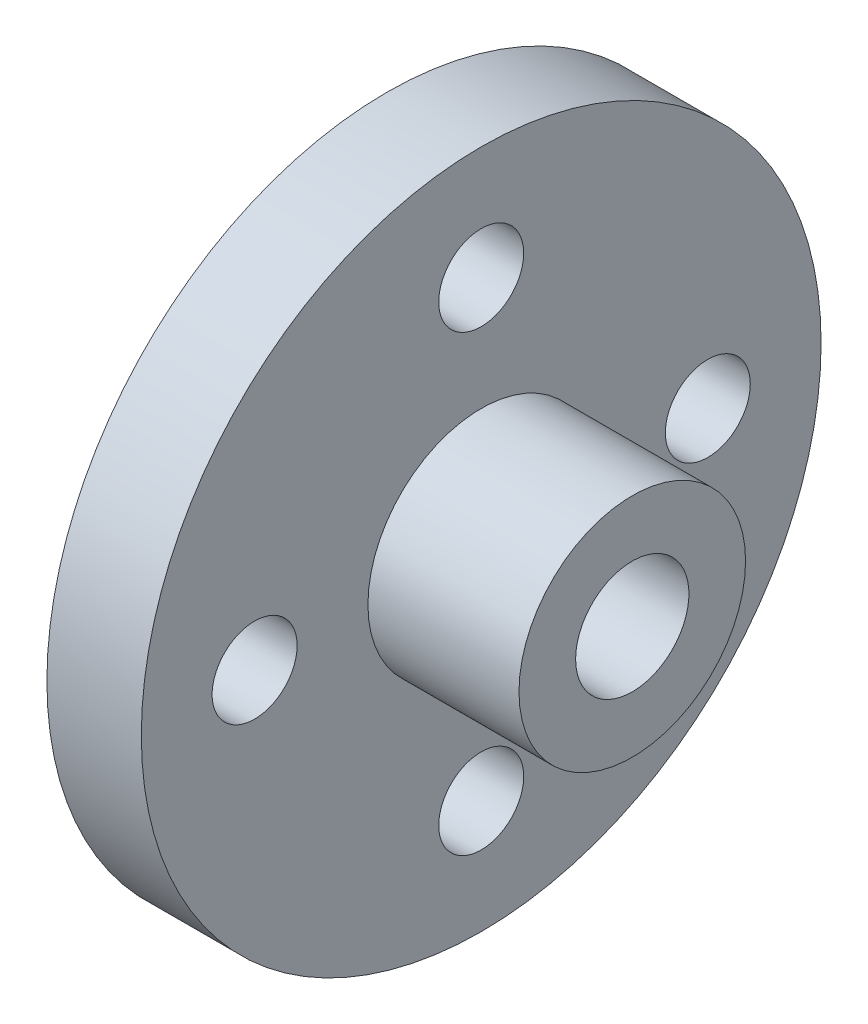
SolidWorks part; units mm, degrees
ref_plane "Front" through (0, 0, 0) normal (0, 0, 1) x (1, 0, 0)
ref_plane "Top" through (0, 0, 0) normal (0, 1, 0) x (1, 0, 0)
ref_plane "Right" through (0, 0, 0) normal (1, 0, 0) x (0, 0, -1)
sketch "Sketch1" plane through (0, 0, 0) normal (0, 0, 1) x (1, 0, 0)
  line L0 (-16.9595, 0) -> (19.5465, 0) construction
  line L1 (-7.9375, 0) -> (-7.9375, 28.575)
  line L2 (-7.9375, 28.575) -> (0, 28.575)
  line L3 (0, 28.575) -> (0, 9.525)
  line L4 (0, 9.525) -> (12.7, 9.525)
  line L5 (12.7, 9.525) -> (12.7, 0)
  line L6 (12.7, 0) -> (-7.9375, 0)
  dimension "D1" = 19.05
  dimension "D" = 57.15
  dimension "L1" = 7.9375
  dimension "L" = 20.6375
revolve "Base-Revolve" add sketch "Sketch1" angle 360 about L0
other "Hole1"
sketch "Sketch3" plane through (0, 0, 0) normal (1, 0, 0) x (0, 0, -1)
  line L0 (0, 10.8347) -> (0, -10.8347) construction
  circle A0 centre (0, 19.05) radius 3.5719
  circle A1 centre (0, 0) radius 19.05 construction
  dimension "HOLE DIA" = 7.1437
  dimension "B.C. DIA" = 38.1
pattern_circular "CirPattern1" count 4 over 360 about axis through (0, 0, 0) along (1, 0, 0) of "Hole1"
sketch "Sketch4" plane through (0, 0, 0) normal (0, 0, 1) x (1, 0, 0)
  line L0 (-9.485, 0) -> (14.3563, 0) construction
  line L1 (12.7, 0) -> (12.7, 4.7625)
  line L2 (12.7, 4.7625) -> (0, 4.7625)
  line L3 (0, 4.7625) -> (0, 4.191)
  line L4 (0, 4.191) -> (-7.9375, 4.191)
  line L5 (-7.9375, 4.191) -> (-7.9375, 0)
  line L6 (-7.9375, 0) -> (12.7, 0)
  line L7 (-7.9375, 28.575) -> (-7.9375, -28.575) construction
  line L8 (12.7, -9.525) -> (12.7, 9.525) construction
  dimension "MINOR DIA" = 8.382
  dimension "MAJOR DIA" = 9.525
  dimension "L THRD" = 12.7
revolve "Cut-Revolve1" cut sketch "Sketch4" angle 360 about L0
